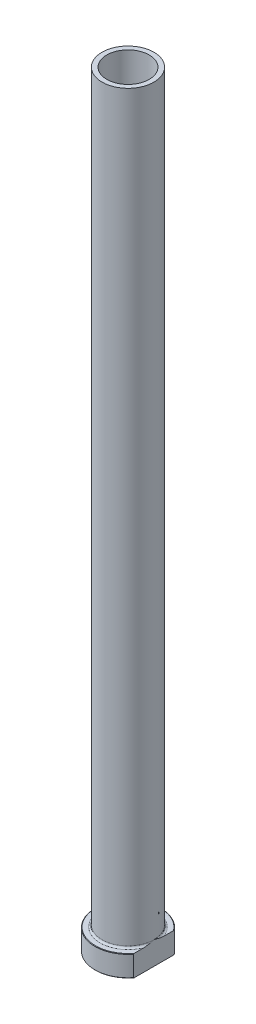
SolidWorks part; units mm, degrees
ref_plane "Front Plane" through (0, 0, 0) normal (0, 0, 1) x (1, 0, 0)
ref_plane "Top Plane" through (0, 0, 0) normal (0, 1, 0) x (1, 0, 0)
ref_plane "Right Plane" through (0, 0, 0) normal (1, 0, 0) x (0, 0, -1)
sketch "Sketch1" plane through (0, 0, 0) normal (0, 0, 1) x (1, 0, 0)
  line L0 (-9, 325) -> (-11, 325)
  line L1 (-11, 325) -> (-11, 9)
  line L2 (-11, 9) -> (-14, 9)
  line L3 (-14, 9) -> (-14, 0)
  line L4 (13.75, 0) -> (-13.75, 0) construction
  line L5 (-14, 0) -> (-9.25, 0)
  line L6 (-9, 270) -> (-9, 325)
  line L7 (0, 92.1877) -> (0, -15.5353) construction
  line L8 (0, -15.4) -> (0, 15.4) construction
  line L9 (-9, 270) -> (-9.25, 258)
  line L10 (-9.25, 258) -> (-9.25, 0)
  dimension "D1" = 0.25
  dimension "ID" = 18
  dimension "OD" = 22
  dimension "L" = 325
  dimension "H" = 28
  dimension "T" = 9
  dimension "N" = 55
  dimension "D2" = 12
  dimension "L-N" = 270
revolve "Revolve1" add sketch "Sketch1" angle 360 about L7
fillet "Fillet1" radius 0.8 1 edges at (0, 9, 11)
chamfer "Chamfer1" distance 0.2 angle 45 2 edges at (0, 9, 14) (0, 0, 14)
sketch "Sketch2" plane through (0, 0, 0) normal (0, -1, 0) x (1, 0, 0)
  line L0 (11, 8.6603) -> (11, -8.6603)
  circle A0 centre (0, 0) radius 14 construction
  arc A1 (11, 8.6603) -> (11, -8.6603) centre (0, 0) cw
  circle A2 centre (0, 0) radius 11 construction
extrude "Cut-Extrude1" cut sketch "Sketch2" against normal through all
chamfer "Chamfer2" distance 0.5 angle 45 1 edges at (0, 0, 9.25)
